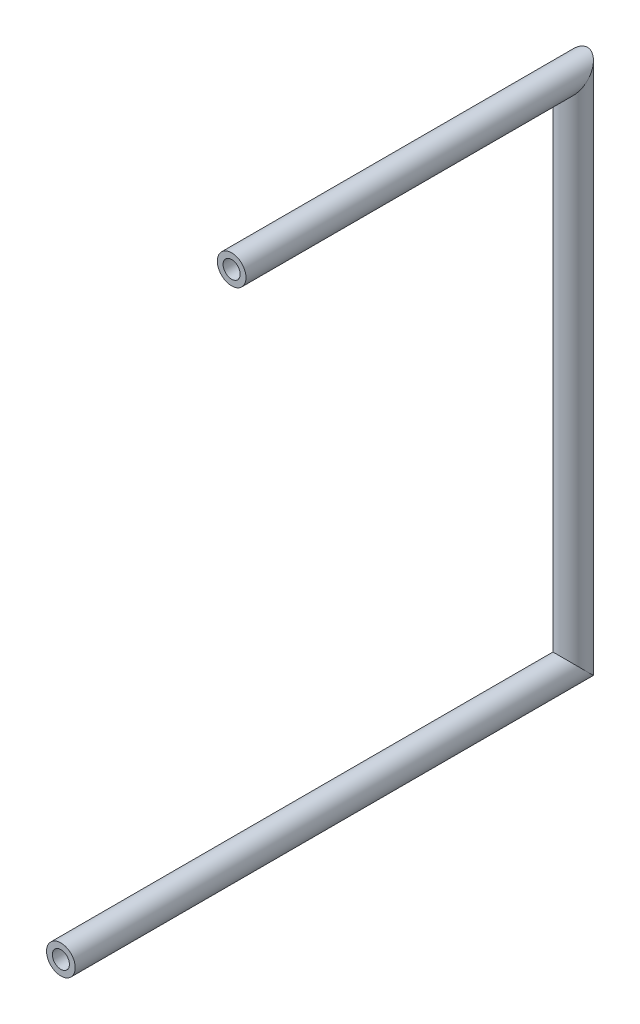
SolidWorks part; units mm, degrees
ref_plane "Front Plane" through (0, 0, 0) normal (0, 0, 1) x (1, 0, 0)
ref_plane "Top Plane" through (0, 0, 0) normal (0, 1, 0) x (1, 0, 0)
ref_plane "Right Plane" through (0, 0, 0) normal (1, 0, 0) x (0, 0, -1)
sketch "Sketch1" plane through (0, 0, 0) normal (0, 0, 1) x (1, 0, 0)
  circle A0 centre (0, 0) radius 6.35
  circle A1 centre (0, 0) radius 10.668
  dimension "D1" = 21.336
  dimension "D2" = 12.7
sketch "Sketch2" plane through (0, 0, 0) normal (1, 0, 0) x (0, 0, -1)
  line L0 (0, 0) -> (381, 0)
  line L1 (381, 0) -> (381, 381)
  line L2 (381, 381) -> (127, 381)
  dimension "D1" = 381
  dimension "D2" = 381
  dimension "D3" = 254
sweep "Sweep1" add profiles "Sketch1" path "Sketch2"
